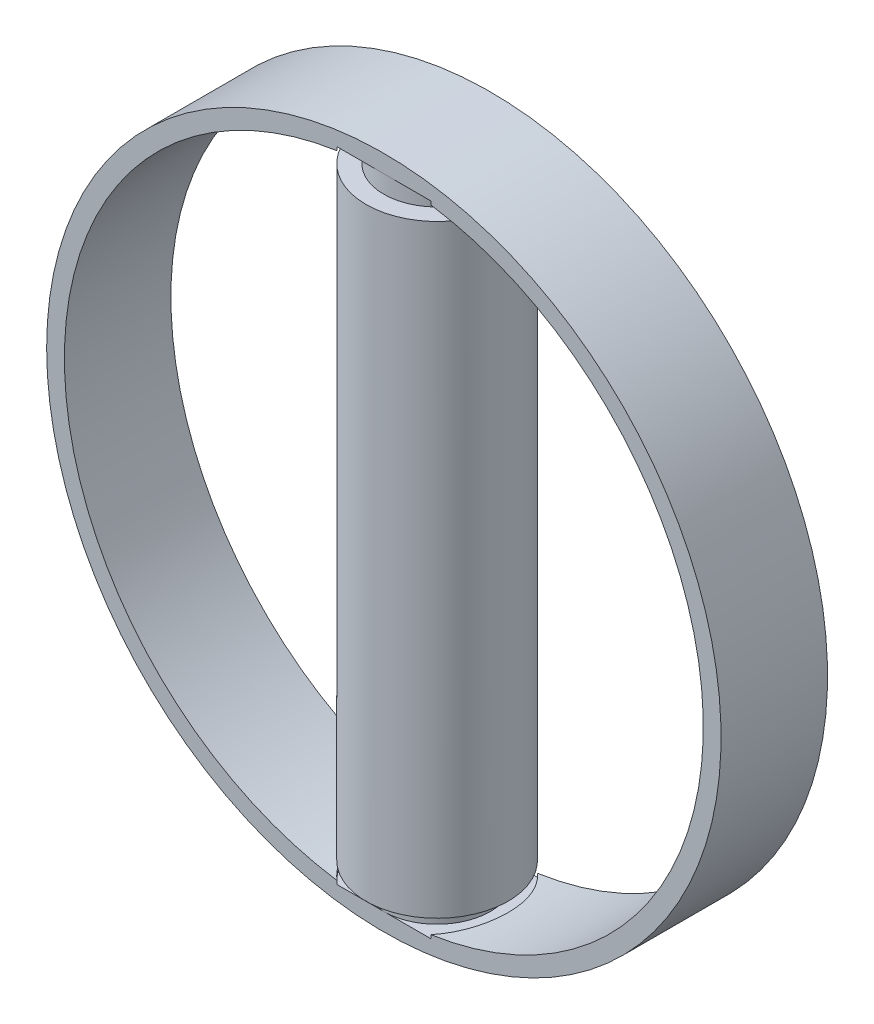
SolidWorks part; units mm, degrees
ref_plane "Front Plane" through (0, 0, 0) normal (0, 0, 1) x (1, 0, 0)
ref_plane "Top Plane" through (0, 0, 0) normal (0, 1, 0) x (1, 0, 0)
ref_plane "Right Plane" through (0, 0, 0) normal (1, 0, 0) x (0, 0, -1)
sketch "Sketch1" plane through (0, 0, 0) normal (0, 1, 0) x (1, 0, 0)
  circle A0 centre (0, 0) radius 12.7
  dimension "D1" = 25.4
extrude "Boss-Extrude1" add sketch "Sketch1" along normal blind 114.3
sketch "Sketch2" plane through (0, 0, 0) normal (0, 0, 1) x (1, 0, 0)
  line L0 (0, 0) -> (0, 114.3) construction
  line L1 (12.7, 114.3) -> (-12.7, 114.3) construction
  circle A0 centre (0, 57.15) radius 57.15
  circle A1 centre (0, 57.15) radius 60.325
  dimension "D1" = 114.3
  dimension "D2" = 120.65
extrude "Boss-Extrude2" add sketch "Sketch2" along normal mid plane 19.05
sketch "Sketch3" plane through (0, 114.3, 0) normal (0, 1, 0) x (1, 0, 0)
  line L0 (60.325, 9.525) -> (-60.325, 9.525) construction
  circle A0 centre (0, 0) radius 12.7
  circle A1 centre (0, 0) radius 9.525
  arc A2 (8.4003, 9.525) -> (-8.4003, 9.525) centre (0, 0) ccw construction
extrude "Cut-Extrude1" cut sketch "Sketch3" against normal blind 3.175
sketch "Sketch4" plane through (0, 0, 0) normal (0, -1, 0) x (1, 0, 0)
  line L0 (60.325, 9.525) -> (-60.325, 9.525) construction
  circle A0 centre (0, 0) radius 12.7
  circle A1 centre (0, 0) radius 9.525
  arc A2 (8.4003, 9.525) -> (-8.4003, 9.525) centre (0, 0) ccw construction
extrude "Cut-Extrude2" cut sketch "Sketch4" against normal blind 3.175
